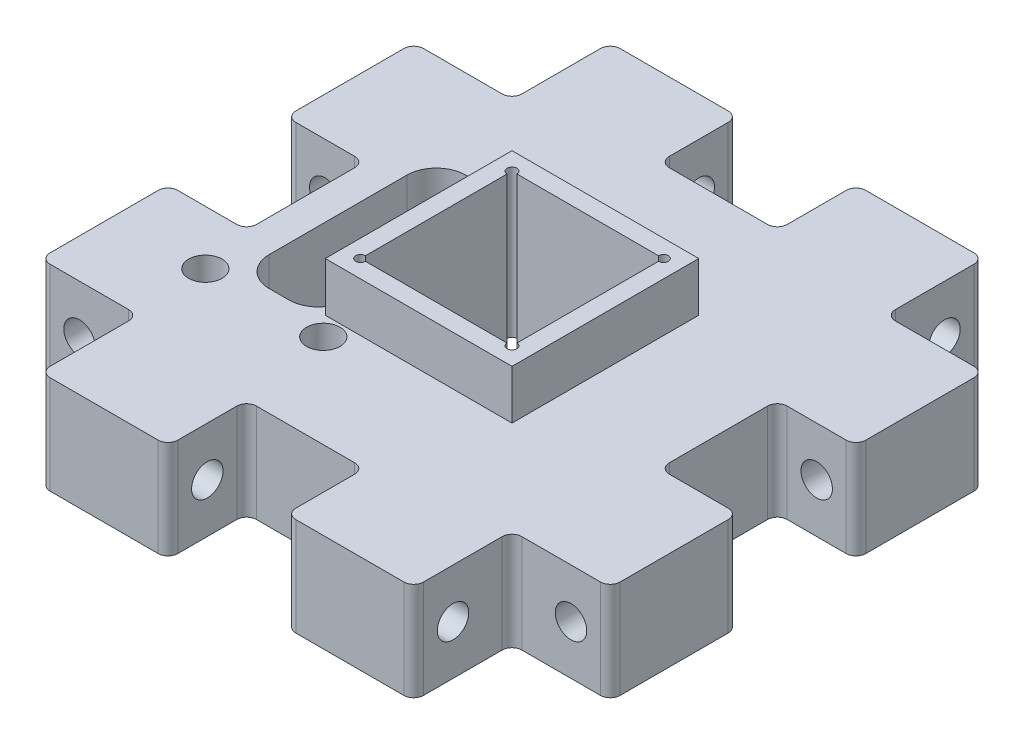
SolidWorks part; units mm, degrees
ref_plane "Front" through (0, 0, 0) normal (0, 0, 1) x (1, 0, 0)
ref_plane "Top" through (0, 0, 0) normal (0, 1, 0) x (1, 0, 0)
ref_plane "Right" through (0, 0, 0) normal (1, 0, 0) x (0, 0, -1)
sketch "草图1" plane through (0, 0, 0) normal (0, 1, 0) x (1, 0, 0)
  line L1 (-29, -29) -> (29, -29)
  line L2 (-29, -29) -> (-29, 29)
  line L3 (-29, 29) -> (29, 29)
  line L4 (29, -29) -> (29, 29)
  line L5 (-29, -29) -> (29, 29) construction
  line L6 (-29, 29) -> (29, -29) construction
  line L7 (-7.7, -7.7) -> (7.7, -7.7)
  line L8 (-7.7, -7.7) -> (-7.7, 7.7)
  line L9 (-7.7, 7.7) -> (7.7, 7.7)
  line L10 (7.7, -7.7) -> (7.7, 7.7)
  line L11 (-7.7, -7.7) -> (7.7, 7.7) construction
  line L12 (-7.7, 7.7) -> (7.7, -7.7) construction
  point P0 (0, 0)
  point P5 (0, 0)
  dimension "D1" = 58
  dimension "D2" = 58
  dimension "D3" = 15.4
  dimension "D4" = 15.4
extrude "凸台-拉伸1" add sketch "草图1" along normal blind 10
sketch "草图2" plane through (0, 10, 0) normal (0, 1, 0) x (1, 0, 0)
  line L0 (29, 6) -> (21, 6)
  line L1 (29, -29) -> (29, 29) construction
  line L2 (21, 6) -> (21, -6)
  line L3 (21, -6) -> (29, -6)
  line L5 (-6, 29) -> (-6, 21)
  line L6 (6, 21) -> (6, 29)
  line L7 (-6, 21) -> (6, 21)
  line L8 (-29, -6) -> (-21, -6)
  line L9 (-21, 6) -> (-29, 6)
  line L10 (-21, -6) -> (-21, 6)
  line L11 (6, -29) -> (6, -21)
  line L12 (-6, -21) -> (-6, -29)
  line L13 (6, -21) -> (-6, -21)
  point P23 (0, 0)
  dimension "D1" = 8
  dimension "D2" = 12
  dimension "D3" = 6
  dimension "D4" = 4
extrude "切除-拉伸1" cut sketch "草图2" against normal up to next contours L5 L7 L6 M14 | L2 L3 L0 M13 | L11 L13 L12 M16 | L8 L10 L9 M15
sketch "草图4" plane through (-29, 0, 0) normal (-1, 0, 0) x (0, 0, 1)
  line L0 (-29, 10) -> (-6, 10) construction
  line L1 (-29, 10) -> (-29, 0) construction
  circle A0 centre (-25, 5) radius 1.6
  dimension "D1" = 3.2
  dimension "D2" = 5
  dimension "D3" = 4
extrude "切除-拉伸2" cut sketch "草图4" against normal up to surface (58 mm away)
sketch "草图5" plane through (0, 0, -29) normal (0, 0, -1) x (-1, 0, 0)
  line L0 (6, 0) -> (29, 0) construction
  line L1 (29, 10) -> (29, 0) construction
  circle A0 centre (25, 5) radius 1.6
  dimension "D1" = 5
  dimension "D2" = 4
  dimension "D3" = 3.2
extrude "切除-拉伸3" cut sketch "草图5" against normal up to surface (58 mm away)
sketch "草图6" plane through (-29, 0, 0) normal (-1, 0, 0) x (0, 0, 1)
  line L0 (6, 0) -> (29, 0) construction
  line L1 (29, 10) -> (29, 0) construction
  circle A0 centre (25, 5) radius 1.6
  dimension "D1" = 5
  dimension "D2" = 4
  dimension "D3" = 3.2
extrude "切除-拉伸4" cut sketch "草图6" against normal up to surface (58 mm away)
sketch "草图7" plane through (0, 0, 29) normal (0, 0, 1) x (1, 0, 0)
  line L0 (6, 0) -> (29, 0) construction
  line L1 (29, 10) -> (29, 0) construction
  circle A0 centre (25, 5) radius 1.6
  dimension "D1" = 5
  dimension "D2" = 4
  dimension "D3" = 3.2
extrude "切除-拉伸5" cut sketch "草图7" against normal up to surface (58 mm away)
sketch "草图8" plane through (0, 0, 0) normal (0, -1, 0) x (1, 0, 0)
  line L0 (-7.7, -7.7) -> (-7.7, 7.7) construction
  line L1 (-17.7, 10) -> (-9.7, 10)
  line L2 (-9.7, 10) -> (-9.7, -10)
  line L3 (-9.7, -10) -> (-17.7, -10)
  line L4 (-17.7, 10) -> (-17.7, -10)
  dimension "D1" = 20
  dimension "D2" = 2
  dimension "D3" = 8
  dimension "D4" = 10
extrude "切除-拉伸6" cut sketch "草图8" against normal up to next
sketch "草图9" plane through (0, 0, 0) normal (0, -1, 0) x (-1, 0, 0)
  circle A0 centre (-7.7, -7.7) radius 0.5
  circle A1 centre (-7.7, 7.7) radius 0.5
  circle A2 centre (7.7, 7.7) radius 0.5
  circle A3 centre (7.7, -7.7) radius 0.5
  dimension "D1" = 1
  dimension "D2" = 1
  dimension "D3" = 1
  dimension "D4" = 1
extrude "切除-拉伸7" cut sketch "草图9" against normal up to next
sketch "草图10" plane through (0, 10, 0) normal (0, 1, 0) x (1, 0, 0)
  line L0 (7.2, 7.7) -> (-7.2, 7.7) construction
  line L1 (-7.7, 7.2) -> (-7.7, -7.2) construction
  line L2 (-7.2, -7.7) -> (7.2, -7.7) construction
  line L3 (7.7, -7.2) -> (7.7, 7.2) construction
  line L4 (7.2, 7.7) -> (-7.2, 7.7)
  line L5 (-7.7, 7.2) -> (-7.7, -7.2)
  line L6 (-7.2, -7.7) -> (7.2, -7.7)
  line L7 (7.7, -7.2) -> (7.7, 7.2)
  line L9 (9.5, 9.5) -> (-9.5, 9.5)
  line L10 (9.5, 9.5) -> (9.5, -9.5)
  line L11 (9.5, -9.5) -> (-9.5, -9.5)
  line L12 (-9.5, 9.5) -> (-9.5, -9.5)
  line L13 (9.5, 9.5) -> (-9.5, -9.5) construction
  line L14 (9.5, -9.5) -> (-9.5, 9.5) construction
  arc A0 (7.7, 7.2) -> (7.2, 7.7) centre (7.7, 7.7) ccw construction
  arc A1 (-7.2, 7.7) -> (-7.7, 7.2) centre (-7.7, 7.7) ccw construction
  arc A2 (-7.7, -7.2) -> (-7.2, -7.7) centre (-7.7, -7.7) ccw construction
  arc A3 (7.2, -7.7) -> (7.7, -7.2) centre (7.7, -7.7) ccw construction
  arc A4 (7.7, 7.2) -> (7.2, 7.7) centre (7.7, 7.7) ccw
  arc A5 (-7.2, 7.7) -> (-7.7, 7.2) centre (-7.7, 7.7) ccw
  arc A6 (-7.7, -7.2) -> (-7.2, -7.7) centre (-7.7, -7.7) ccw
  arc A7 (7.2, -7.7) -> (7.7, -7.2) centre (7.7, -7.7) ccw
  point P11 (0, 0)
  dimension "D1" = 19
  dimension "D2" = 19
extrude "凸台-拉伸2" add sketch "草图10" along normal blind 5
sketch "草图12" plane through (0, 0, 0) normal (0, -1, 0) x (1, 0, 0)
  line L1 (-29, 29) -> (-19, 29)
  line L2 (-29, 29) -> (-29, 19)
  line L3 (-29, 19) -> (-19, 19)
  line L4 (-19, 29) -> (-19, 19)
  line L5 (29, 29) -> (19, 29)
  line L6 (29, 29) -> (29, 19)
  line L7 (29, 19) -> (19, 19)
  line L8 (19, 29) -> (19, 19)
  line L9 (29, -29) -> (19, -29)
  line L10 (29, -29) -> (29, -19)
  line L11 (29, -19) -> (19, -19)
  line L12 (19, -29) -> (19, -19)
  line L13 (-29, -29) -> (-19, -29)
  line L14 (-29, -29) -> (-29, -19)
  line L15 (-29, -19) -> (-19, -19)
  line L16 (-19, -29) -> (-19, -19)
  dimension "D1" = 10
  dimension "D2" = 10
  dimension "D3" = 10
  dimension "D4" = 10
  dimension "D5" = 10
  dimension "D6" = 10
  dimension "D7" = 10
  dimension "D8" = 10
extrude "切除-拉伸8" cut sketch "草图12" against normal up to next
fillet "圆角2" radius 1 16 edges at (-29, 5, -6) (-29, 5, -19) (-19, 5, -29) (-6, 5, -29) (6, 5, -29) (19, 5, -29) (29, 5, -19) (29, 5, -6) (29, 5, 6) (29, 5, 19) (19, 5, 29) (6, 5, 29) (-6, 5, 29) (-29, 5, 6) (-29, 5, 19) (-19, 5, 29)
hole_wizard "Ø3.4 (3.4) 直径孔1" positions "草图13" profile "草图14" hole size "Ø3.4" standard "GB"
sketch "草图13" plane through (0, 10, 0) normal (0, 1, 0) x (1, 0, 0)
  line L0 (-17.7, 10) -> (-17.7, -10) construction
  line L1 (-9.7, -10) -> (-9.7, 10) construction
  line L2 (-17.7, -10) -> (-9.7, -10) construction
  point P0 (-19.7, -11.5)
  point P2 (-7.7, -11.5)
  dimension "D1" = 2
  dimension "D2" = 2
  dimension "D3" = 1.5
  dimension "D4" = 1.5
sketch "草图14" plane through (-19.7, 10, 11.5) normal (1, 0, 0) x (0, 0, 1)
  line L0 (0, 0) -> (0, 10)
  line L1 (0, 10) -> (1.7, 10)
  line L2 (1.7, 10) -> (1.7, 0)
  line L5 (1.7, 0) -> (0, 0)
  line L11 (0, -6.35) -> (0, 107.95) construction
  dimension "通孔孔直径" = 3.4
  dimension "通孔孔深度" = 10
fillet "圆角3" radius 3 4 edges at (-17.7, 5, 10) (-17.7, 5, -10) (-9.7, 5, -10) (-9.7, 5, 10)
fillet "圆角4" radius 1 12 edges at (-6, 5, -21) (6, 5, -21) (19, 5, -19) (21, 5, -6) (21, 5, 6) (19, 5, 19) (6, 5, 21) (-6, 5, 21) (-19, 5, 19) (-21, 5, 6) (-21, 5, -6) (-19, 5, -19)
sketch "草图15" plane through (0, 0, 0) normal (0, -1, 0) x (1, 0, 0)
  line L0 (-28, 19) -> (-20, 19) construction
  line L1 (-17.9679, 14.5) -> (-21.4321, 14.5)
  line L2 (-21.4321, 14.5) -> (-23.1641, 11.5)
  line L3 (-23.1641, 11.5) -> (-21.4321, 8.5)
  line L4 (-21.4321, 8.5) -> (-17.9679, 8.5)
  line L5 (-17.9679, 8.5) -> (-16.2359, 11.5)
  line L6 (-16.2359, 11.5) -> (-17.9679, 14.5)
  line L7 (-5.9679, 14.5) -> (-9.4321, 14.5)
  line L8 (-9.4321, 14.5) -> (-11.1641, 11.5)
  line L9 (-11.1641, 11.5) -> (-9.4321, 8.5)
  line L10 (-9.4321, 8.5) -> (-5.9679, 8.5)
  line L11 (-5.9679, 8.5) -> (-4.2359, 11.5)
  line L12 (-4.2359, 11.5) -> (-5.9679, 14.5)
  circle A0 centre (-19.7, 11.5) radius 3 construction
  circle A1 centre (-7.7, 11.5) radius 3 construction
  dimension "D2" = 6
  dimension "D1" = 6
extrude "切除-拉伸9" cut sketch "草图15" against normal blind 2.4
